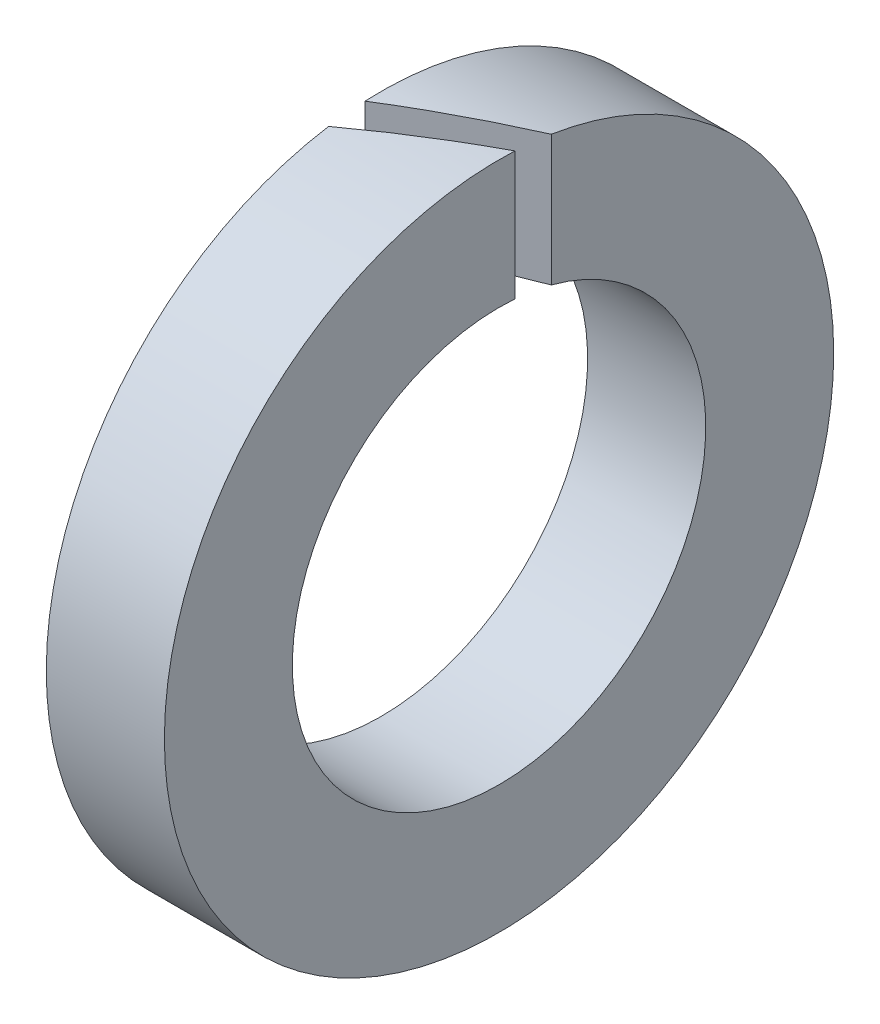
SolidWorks part; units mm, degrees
ref_plane "Plan1" through (0, 0, 0) normal (0, 0, 1) x (1, 0, 0)
ref_plane "Plan2" through (0, 0, 0) normal (0, 1, 0) x (1, 0, 0)
ref_plane "Plan3" through (0, 0, 0) normal (1, 0, 0) x (0, 0, -1)
sketch "Esquisse1" plane through (0, 0, 0) normal (1, 0, 0) x (0, 0, -1)
  circle A0 centre (0, 0) radius 8.5
  circle A1 centre (0, 0) radius 5.25
  dimension "D1" = 17
  dimension "D2" = 10.5
extrude "Base-Extrusion" add sketch "Esquisse1" along normal blind 3
sketch "Esquisse2" plane through (0, 0, 0) normal (0, 1, 0) x (1, 0, 0)
  line L0 (-0.4428, -0.6598) -> (-0.089, -1.3793)
  line L7 (-0.089, -1.3793) -> (4.0168, 0.9912)
  line L8 (-0.4428, -0.6598) -> (3.6168, 1.684)
  line L10 (3.6168, 1.684) -> (4.0168, 0.9912)
extrude "Enlèv. mat.-Extru.1" cut sketch "Esquisse2" along normal through all
